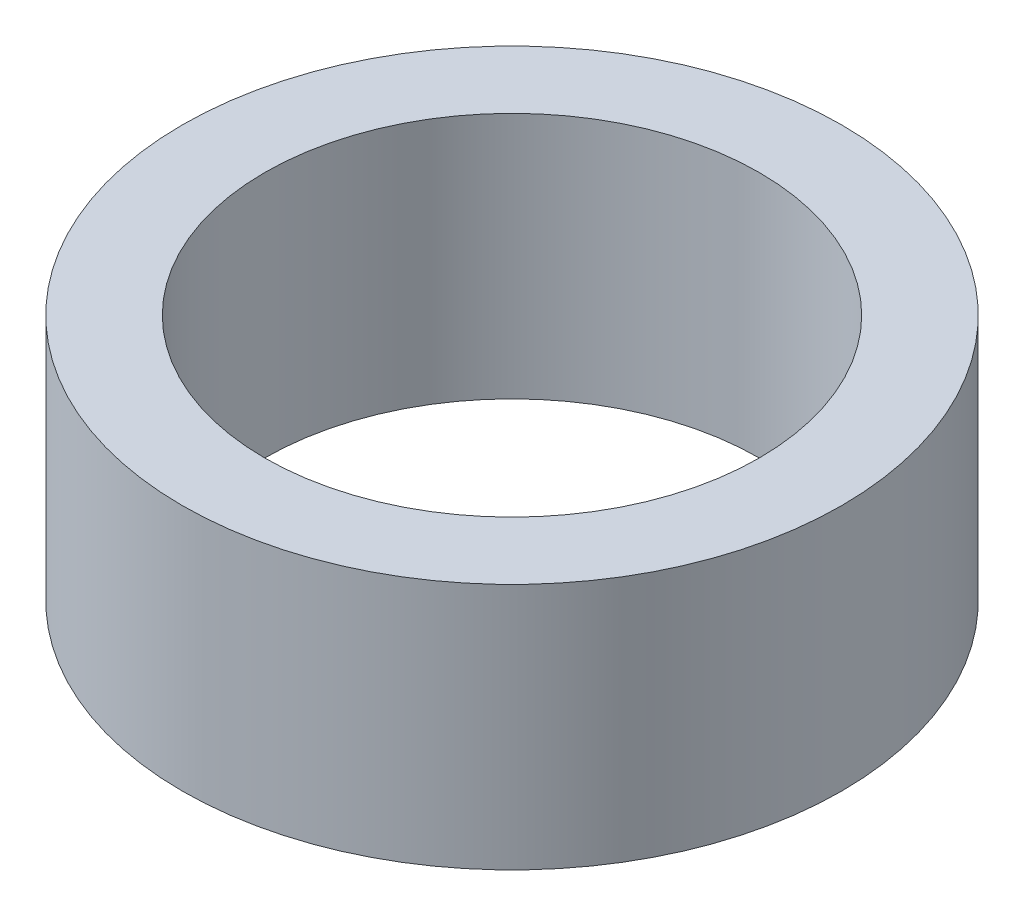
SolidWorks part; units mm, degrees
ref_plane "Front Plane" through (0, 0, 0) normal (0, 0, 1) x (1, 0, 0)
ref_plane "Top Plane" through (0, 0, 0) normal (0, 1, 0) x (1, 0, 0)
ref_plane "Right Plane" through (0, 0, 0) normal (1, 0, 0) x (0, 0, -1)
sketch "Sketch1" plane through (0, 0, 0) normal (0, 1, 0) x (1, 0, 0)
  circle A0 centre (0, 0) radius 1.5
  circle A1 centre (0, 0) radius 2
  dimension "D1" = 3
  dimension "D2" = 4
extrude "Boss-Extrude1" add sketch "Sketch1" along normal blind 1.5
sketch "Sketch2" plane through (0, 0, 0) normal (0, -1, 0) x (1, 0, 0)
  line L0 (0, 0) -> (0, 2) construction
  circle A0 centre (0, 0) radius 2 construction
